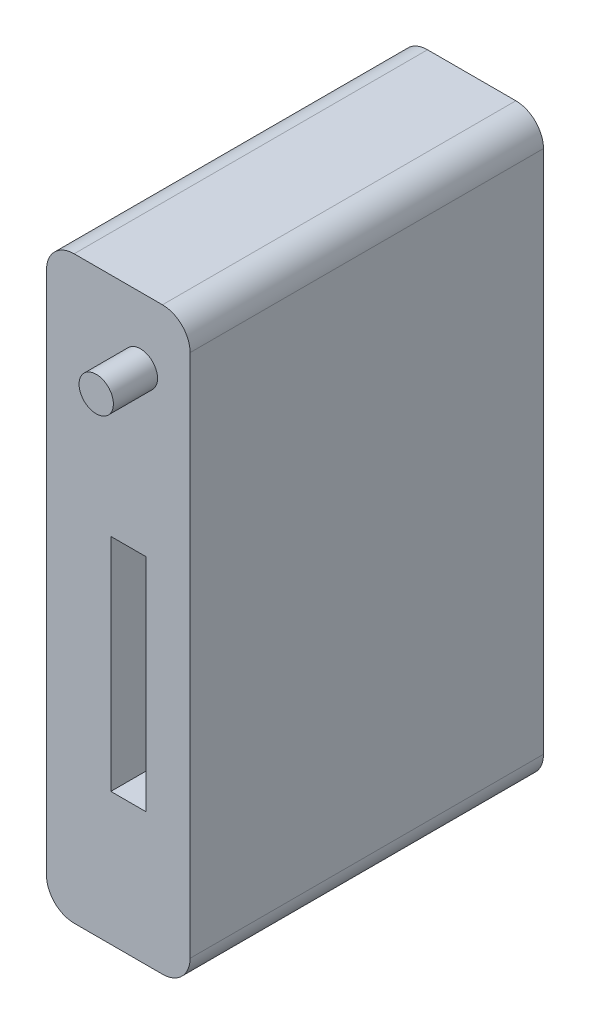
SolidWorks part; units mm, degrees
ref_plane "Front Plane" through (0, 0, 0) normal (0, 0, 1) x (1, 0, 0)
ref_plane "Top Plane" through (0, 0, 0) normal (0, 1, 0) x (1, 0, 0)
ref_plane "Right Plane" through (0, 0, 0) normal (1, 0, 0) x (0, 0, -1)
sketch "Sketch1" plane through (0, 0, 0) normal (0, 0, 1) x (1, 0, 0)
  line L1 (-8, -52.5) -> (8, -52.5)
  line L2 (-13, -47.5) -> (-13, 47.5)
  line L3 (-8, 52.5) -> (8, 52.5)
  line L4 (13, -47.5) -> (13, 47.5)
  line L5 (-13, -52.5) -> (13, 52.5) construction
  line L6 (-13, 52.5) -> (13, -52.5) construction
  arc A0 (-8, -52.5) -> (-13, -47.5) centre (-8, -47.5) cw
  arc A1 (8, -52.5) -> (13, -47.5) centre (8, -47.5) ccw
  arc A2 (8, 52.5) -> (13, 47.5) centre (8, 47.5) cw
  arc A3 (-13, 47.5) -> (-8, 52.5) centre (-8, 47.5) cw
  point P0 (0, 0)
  dimension "D3" = 5
  dimension "D1" = 26
  dimension "D2" = 105
extrude "Boss-Extrude1" add sketch "Sketch1" along normal mid plane 64
sketch "Sketch2" plane through (0, 0, 32) normal (0, 0, 1) x (1, 0, 0)
  line L0 (13, -47.5) -> (13, 47.5) construction
  line L1 (-1.35, -28.5) -> (5, -28.5)
  line L2 (-1.35, -28.5) -> (-1.35, 11.5)
  line L3 (-1.35, 11.5) -> (5, 11.5)
  line L4 (5, -28.5) -> (5, 11.5)
  line L5 (-8, -52.5) -> (8, -52.5) construction
  dimension "D1" = 6.35
  dimension "D2" = 40
  dimension "D3" = 8
  dimension "D4" = 24
extrude "Cut-Extrude1" cut sketch "Sketch2" against normal blind 7.62
sketch "Sketch3" plane through (0, 0, 32) normal (0, 0, 1) x (1, 0, 0)
  line L0 (8, 52.5) -> (-8, 52.5) construction
  line L1 (13, -47.5) -> (13, 47.5) construction
  circle A0 centre (4, 40.5) radius 3.105
  dimension "D1" = 6.21
  dimension "D2" = 12
  dimension "D3" = 9
extrude "Boss-Extrude2" add sketch "Sketch3" along normal blind 8
